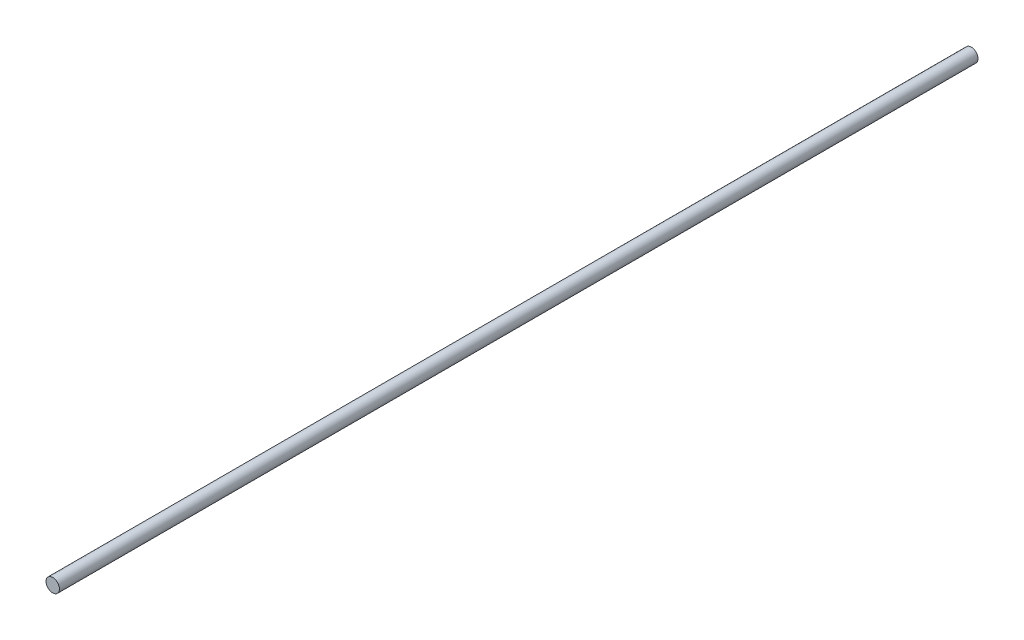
SolidWorks part; units mm, degrees
ref_plane "Front Plane" through (0, 0, 0) normal (0, 0, 1) x (1, 0, 0)
ref_plane "Top Plane" through (0, 0, 0) normal (0, 1, 0) x (1, 0, 0)
ref_plane "Right Plane" through (0, 0, 0) normal (1, 0, 0) x (0, 0, -1)
sketch "Sketch1" plane through (0, 0, 0) normal (0, 0, 1) x (1, 0, 0)
  circle A0 centre (0, 0) radius 30
  dimension "D1" = 60
extrude "Boss-Extrude1" add sketch "Sketch1" against normal blind 4100
